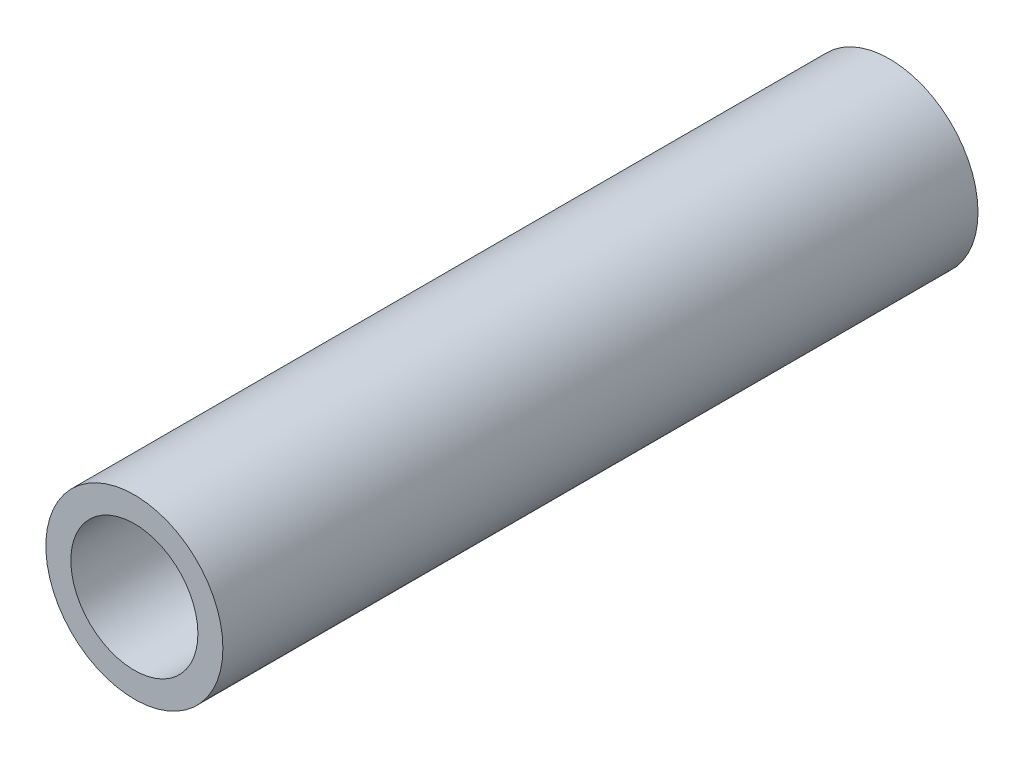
SolidWorks part; units mm, degrees
ref_plane "Front Plane" through (0, 0, 0) normal (0, 0, 1) x (1, 0, 0)
ref_plane "Top Plane" through (0, 0, 0) normal (0, 1, 0) x (1, 0, 0)
ref_plane "Right Plane" through (0, 0, 0) normal (1, 0, 0) x (0, 0, -1)
sketch "Sketch1" plane through (0, 0, 0) normal (0, 0, 1) x (1, 0, 0)
  circle A0 centre (0, 0) radius 7.747
  circle A1 centre (0, 0) radius 10.795
  dimension "D1" = 15.494
  dimension "D2" = 21.59
extrude "Boss-Extrude1" add sketch "Sketch1" along normal blind 92.075
